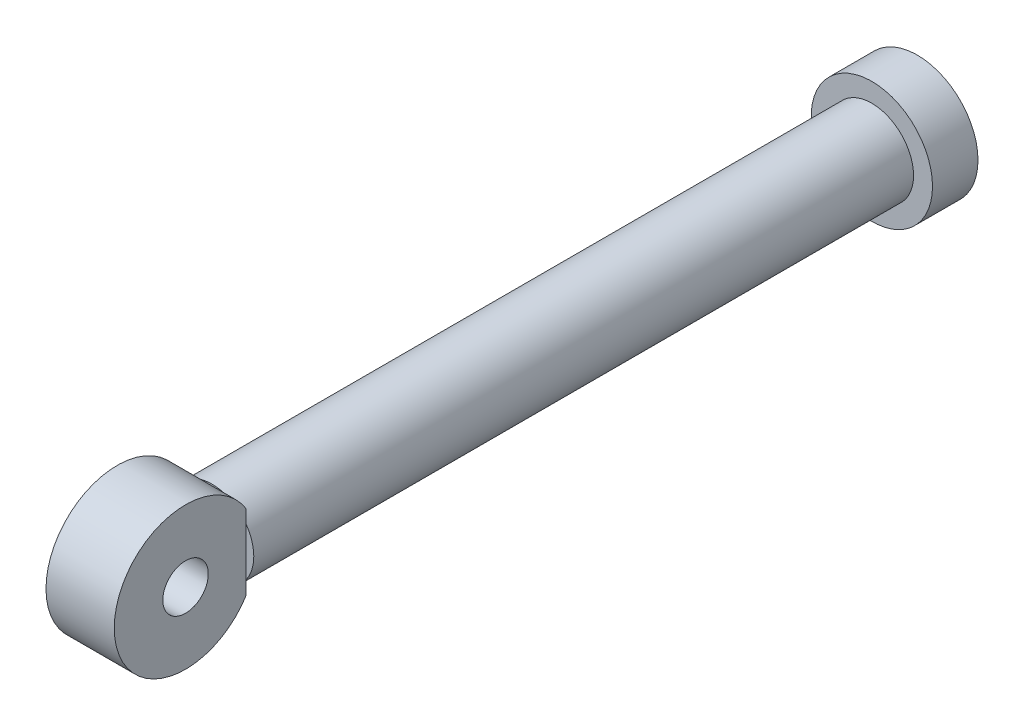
SolidWorks part; units mm, degrees
ref_plane "前视基准面" through (0, 0, 0) normal (0, 0, 1) x (1, 0, 0)
ref_plane "上视基准面" through (0, 0, 0) normal (0, 1, 0) x (1, 0, 0)
ref_plane "右视基准面" through (0, 0, 0) normal (1, 0, 0) x (0, 0, -1)
sketch "草图1" plane through (0, 0, 0) normal (0, 0, 1) x (1, 0, 0)
  circle A0 centre (0, 0) radius 40
  dimension "D1" = 80
extrude "拉伸1" add sketch "草图1" along normal blind 30
sketch "草图2" plane through (0, 0, 30) normal (0, 0, 1) x (1, 0, 0)
  circle A0 centre (0, 0) radius 27.5
  dimension "D1" = 55
extrude "拉伸2" add sketch "草图2" along normal blind 435
sketch "草图3" plane through (0, 0, 0) normal (1, 0, 0) x (0, 0, -1)
  line L0 (-352.846, 0) -> (-650.8079, 0) construction
  line L1 (-465, 27.5) -> (-465, -27.5) construction
  line L2 (-465, 24.6779) -> (-465, -24.6779)
  arc A0 (-465, 24.6779) -> (-465, -24.6779) centre (-505, 0) ccw
  circle A1 centre (-505, 0) radius 15
  dimension "D1" = 94
  dimension "D3" = 30
  dimension "D2" = 40
extrude "拉伸3" add sketch "草图3" along normal mid plane 45
